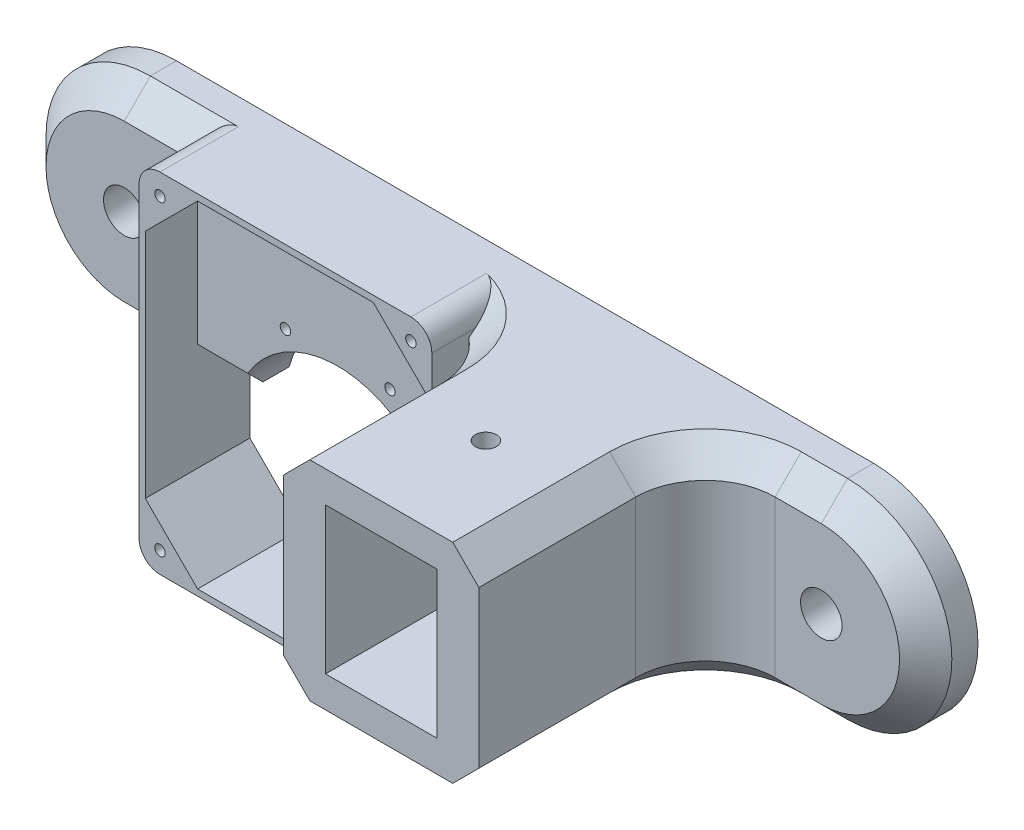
SolidWorks part; units mm, degrees
ref_plane "Plan de face" through (0, 0, 0) normal (0, 0, 1) x (1, 0, 0)
ref_plane "Plan de dessus" through (0, 0, 0) normal (0, 1, 0) x (1, 0, 0)
ref_plane "Plan de droite" through (0, 0, 0) normal (1, 0, 0) x (0, 0, -1)
sketch "Esquisse1" plane through (0, 0, 0) normal (0, 0, 1) x (1, 0, 0)
  line L0 (100, -1) -> (-100, -1) construction
  line L1 (100, -30.95) -> (86.75, -30.95)
  line L2 (100, 28.95) -> (-100, 28.95)
  line L3 (0, 0) -> (0, 35.8491) construction
  line L4 (38.75, -22) -> (38.75, -30.95) construction
  line L5 (54.75, -22) -> (22.75, -22)
  line L6 (54.75, -22) -> (54.75, 20)
  line L7 (54.75, 20) -> (22.75, 20)
  line L8 (22.75, -22) -> (22.75, 20)
  line L9 (-9.25, -30.95) -> (86.75, -30.95)
  line L11 (-9.25, -30.95) -> (-100, -30.95)
  arc A0 (100, -30.95) -> (100, 28.95) centre (100, -1) ccw
  arc A1 (-100, 28.95) -> (-100, -30.95) centre (-100, -1) ccw
  circle A2 centre (-100, -1) radius 5.95
  circle A3 centre (100, -1) radius 5.95
  point P2 (0, 0)
  point P18 (38.75, 20)
  point P21 (38.75, -53.35)
  point P22 (22.75, -1)
  dimension "D2" = 11.9
  dimension "D3" = 24
  dimension "D1" = 200
  dimension "D5" = 38.75
  dimension "D6" = 32
  dimension "D7" = 42
extrude "Boss.-Extru.1" add sketch "Esquisse1" along normal blind 80
sketch "Esquisse3" plane through (0, 0, 0) normal (0, 1, 0) x (1, 0, 0)
  line L0 (100, 0) -> (-100, 0) construction
  line L1 (-129.95, -80) -> (10.75, -80)
  line L2 (-129.95, -80) -> (-129.95, -15)
  line L3 (-129.95, -15) -> (-9.25, -15)
  line L4 (10.75, -80) -> (10.75, -35)
  line L5 (129.95, -80) -> (66.75, -80)
  line L6 (129.95, -80) -> (129.95, -15)
  line L7 (129.95, -15) -> (86.75, -15)
  line L8 (66.75, -80) -> (66.75, -35)
  line L9 (22.75, -80) -> (22.75, 0) construction
  line L10 (54.75, -80) -> (54.75, 0) construction
  line L11 (54.75, 0) -> (22.75, -80) construction
  line L12 (22.75, -80) -> (38.75, -40) construction
  line L13 (38.75, -40) -> (38.75, -50) construction
  line L14 (100, -80) -> (-100, -80) construction
  arc A0 (86.75, -15) -> (66.75, -35) centre (86.75, -35) ccw
  arc A1 (-9.25, -15) -> (10.75, -35) centre (-9.25, -35) cw
  circle A2 centre (38.75, -50) radius 3
  dimension "D4" = 20
  dimension "D5" = 6
  dimension "D6" = 30
  dimension "D1" = 15
  dimension "D2" = 12
  dimension "D3" = 12
extrude "Enlèv. mat.-Extru.1" cut sketch "Esquisse3" against normal through all both and the other way through all
chamfer "Chanfrein1" distance 7.5 angle 45 14 edges at (66.75, -30.95, 57.5) (72.6079, -30.95, 20.8579) (93.375, -30.95, 15) (129.95, -1, 15) (93.375, 28.95, 15) (66.75, 28.95, 57.5) (72.6079, 28.95, 20.8579) (10.75, -30.95, 57.5) (4.8921, -30.95, 20.8579) (10.75, 28.95, 57.5) (-54.625, -30.95, 15) (4.8921, 28.95, 20.8579) (-129.95, -1, 15) (-54.625, 28.95, 15)
sketch "Esquisse4" plane through (0, 0, 15) normal (0, 0, 1) x (1, 0, 0)
  line L0 (-100, 28.95) -> (-9.25, 28.95) construction
  line L1 (-53.75, -7.05) -> (-23.75, 18.95) construction
  line L3 (-20.75, -10.05) -> (-56.75, -10.05) construction
  line L4 (-20.75, -10.05) -> (-20.75, 21.95) construction
  line L5 (-20.75, 21.95) -> (-56.75, 21.95) construction
  line L6 (-56.75, -10.05) -> (-56.75, 21.95) construction
  line L7 (-20.75, -10.05) -> (-56.75, 21.95) construction
  line L8 (-20.75, 21.95) -> (-56.75, -10.05) construction
  circle A0 centre (-38.75, -38.75) radius 30
  circle A1 centre (-53.75, 18.95) radius 1.5
  circle A2 centre (-23.75, 18.95) radius 1.5
  circle A3 centre (-23.75, -7.05) radius 1.5
  circle A4 centre (-53.75, -7.05) radius 1.5
  point P13 (-38.75, 5.95)
  point P14 (-38.75, 5.95)
  dimension "D2" = 38.75
  dimension "D3" = 60
  dimension "D6" = 30
  dimension "D9" = 3
  dimension "D1" = 38.75
  dimension "D7" = 26
  dimension "D8" = 10
  dimension "D10" = 36
  dimension "D11" = 32
  dimension "D4" = 2
  dimension "D5" = 2
extrude "Enlèv. mat.-Extru.2" cut sketch "Esquisse4" against normal through all
sketch "Esquisse5" plane through (0, 0, 0) normal (0, 0, -1) x (-1, 0, 0)
  line L0 (23.75, -7.05) -> (53.75, 18.95) construction
  line L1 (53.75, 18.95) -> (38.75, 5.95) construction
  line L2 (38.75, 5.95) -> (38.75, -38.75) construction
  line L3 (-100, 28.95) -> (100, 28.95) construction
  line L4 (74.75, -71.05) -> (2.75, -71.05)
  line L5 (80.75, -65.05) -> (80.75, 22.95)
  line L6 (74.75, 28.95) -> (2.75, 28.95)
  line L7 (-3.25, -65.05) -> (-3.25, 22.95)
  line L8 (80.75, -71.05) -> (-3.25, 28.95) construction
  line L9 (80.75, 28.95) -> (-3.25, -71.05) construction
  line L10 (78.95, -54.25) -> (78.95, 12.15)
  line L11 (63.95, 27.15) -> (13.55, 27.15)
  line L12 (-1.45, -54.25) -> (-1.45, 12.15)
  line L13 (63.95, -69.25) -> (13.55, -69.25)
  line L14 (78.95, -65.05) -> (78.95, 22.95) construction
  line L15 (74.75, 27.15) -> (2.75, 27.15) construction
  line L16 (78.95, 12.15) -> (63.95, 27.15)
  line L17 (74.75, -69.25) -> (2.75, -69.25) construction
  line L18 (-1.45, -65.05) -> (-1.45, 22.95) construction
  line L19 (13.55, -69.25) -> (-1.45, -54.25)
  line L20 (13.55, 27.15) -> (-1.45, 12.15)
  line L21 (78.95, -54.25) -> (63.95, -69.25)
  line L23 (20.75, -10.05) -> (56.75, -10.05) construction
  line L24 (20.75, -10.05) -> (20.75, 21.95) construction
  line L25 (20.75, 21.95) -> (56.75, 21.95) construction
  line L26 (56.75, -10.05) -> (56.75, 21.95) construction
  line L27 (20.75, -10.05) -> (56.75, 21.95) construction
  line L28 (20.75, 21.95) -> (56.75, -10.05) construction
  arc A0 (80.75, -65.05) -> (74.75, -71.05) centre (74.75, -65.05) cw
  arc A1 (2.75, -71.05) -> (-3.25, -65.05) centre (2.75, -65.05) cw
  arc A2 (-3.25, 22.95) -> (2.75, 28.95) centre (2.75, 22.95) cw
  arc A3 (74.75, 28.95) -> (80.75, 22.95) centre (74.75, 22.95) cw
  circle A4 centre (74.75, 22.95) radius 1.5
  circle A5 centre (2.75, 22.95) radius 1.5
  circle A6 centre (23.75, 18.95) radius 1.5 construction
  circle A7 centre (2.75, -65.05) radius 1.5
  circle A8 centre (74.75, -65.05) radius 1.5
  arc A11 (2.75, -69.25) -> (-1.45, -65.05) centre (2.75, -65.05) cw construction
  arc A12 (78.95, -65.05) -> (74.75, -69.25) centre (74.75, -65.05) cw construction
  arc A13 (-1.45, 22.95) -> (2.75, 27.15) centre (2.75, 22.95) cw construction
  arc A14 (74.75, 27.15) -> (78.95, 22.95) centre (74.75, 22.95) cw construction
  point P4 (38.75, -21.05)
  point P44 (78.95, 27.15)
  point P47 (-1.45, -69.25)
  point P50 (-1.45, 27.15)
  point P53 (78.95, -69.25)
  dimension "D3" = 6
  dimension "D2" = 84
  dimension "D11" = 36
  dimension "D12" = 32
  dimension "D13" = 100
  dimension "D14" = 72
  dimension "D15" = 88
  dimension "D4" = 1.8
  dimension "D5" = 2
  dimension "D6" = 2
extrude "Boss.-Extru.2" add sketch "Esquisse5" against normal blind 30
